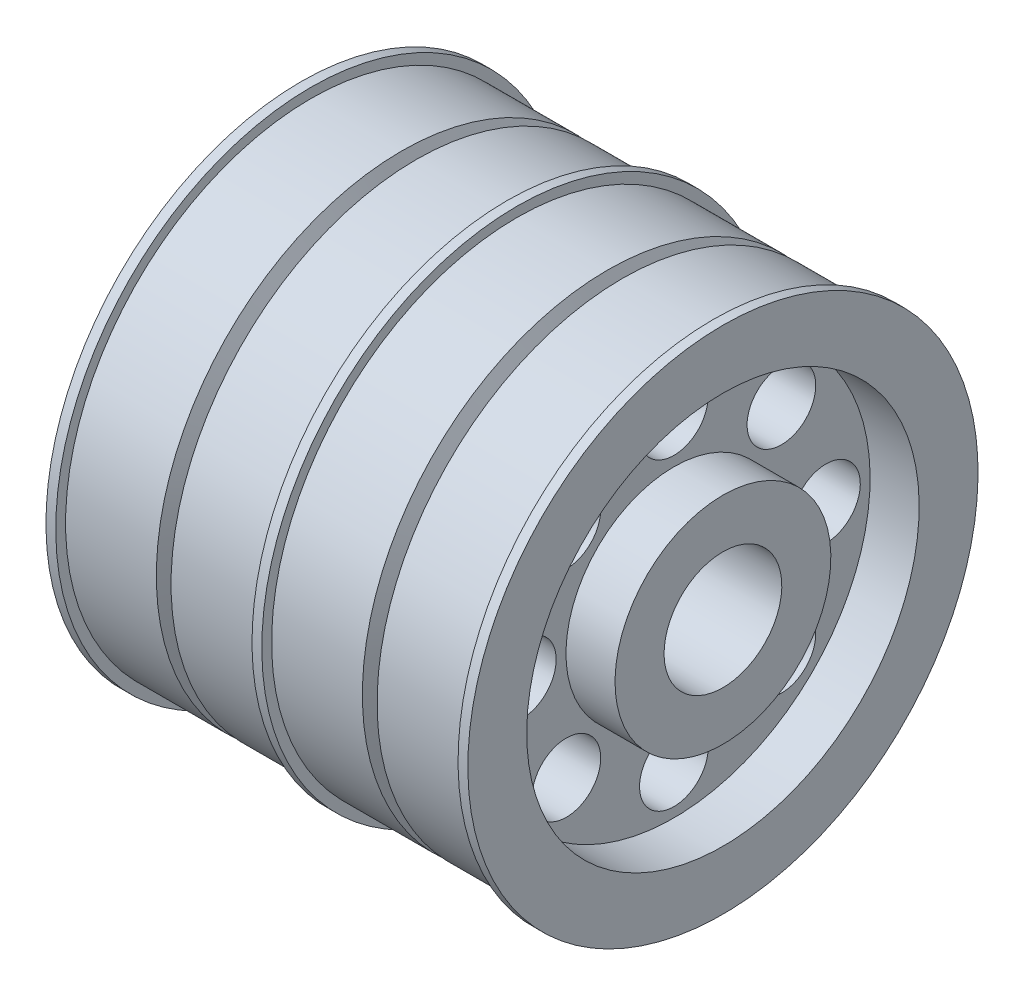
SolidWorks part; units mm, degrees
ref_plane "Front Plane" through (0, 0, 0) normal (0, 0, 1) x (1, 0, 0)
ref_plane "Top Plane" through (0, 0, 0) normal (0, 1, 0) x (1, 0, 0)
ref_plane "Right Plane" through (0, 0, 0) normal (1, 0, 0) x (0, 0, -1)
sketch "Sketch1" plane through (0, 0, 0) normal (0, 0, 1) x (1, 0, 0)
  line L0 (0, 0) -> (0, 10)
  line L1 (0, 10) -> (10, 10)
  line L2 (10, 10) -> (10, 28)
  line L3 (10, 28) -> (0, 28)
  line L4 (0, 28) -> (0, 38)
  line L6 (86, 38) -> (86, 28)
  line L7 (86, 0) -> (0, 0)
  line L8 (86, 0) -> (86, -12) construction
  line L9 (86, -12) -> (66.3916, -12) construction
  line L10 (66.3916, -12) -> (0, -12) construction
  line L16 (44, 38) -> (62.5, 38)
  line L17 (20.5, 38) -> (23.5, 38) construction
  line L20 (0, 38) -> (0, 40)
  line L21 (0, 40) -> (2, 40)
  line L22 (2, 40) -> (2, 38)
  line L23 (84, 40) -> (84, 38)
  line L24 (86, 38) -> (86, 40)
  line L25 (86, 40) -> (84, 40)
  line L27 (44, 38) -> (44, 40)
  line L28 (44, 40) -> (42, 40)
  line L29 (42, 40) -> (42, 38)
  line L32 (43, 44) -> (43, 0) construction
  line L33 (86, 10) -> (76, 10)
  line L34 (76, 10) -> (76, 28)
  line L35 (76, 28) -> (86, 28)
  line L36 (86, 10) -> (86, 0)
  line L37 (2, 38) -> (20.5, 38)
  line L38 (62.5, 38) -> (65.5, 38) construction
  line L42 (23.5, 38) -> (42, 38)
  line L43 (65.5, 38) -> (84, 38)
  line L44 (64, 38) -> (64, 35) construction
  line L46 (20.5, 38) -> (22, 35)
  line L47 (22, 35) -> (23.5, 38)
  line L48 (62.5, 38) -> (64, 35)
  line L49 (64, 35) -> (65.5, 38)
  point P16 (43, 44)
  point P18 (65.5, 38.0005)
  point P29 (43, 44)
  dimension "D1" = 12
  dimension "D3" = 50
  dimension "D4" = 2
  dimension "D5" = 3
  dimension "D6" = 2
  dimension "D7" = 2
  dimension "D8" = 2
  dimension "D9" = 10
  dimension "D10" = 10
  dimension "D11" = 10
  dimension "D12" = 3
  dimension "D13" = 3
  dimension "D14" = 2
  dimension "D15" = 2
  dimension "D16" = 86
  dimension "D17" = 2
  dimension "D18" = 18.5
  dimension "D19" = 18.5
  dimension "D20" = 18.5
  dimension "D21" = 18.5
revolve "Revolve1" add sketch "Sketch1" angle 360 about L10
ref_plane "outer " through (22, 0, 0) normal (-1, 0, 0) x (0, 0, 1)
ref_plane "inner" through (64, 0, 0) normal (1, 0, 0) x (0, 0, -1)
sketch "Sketch3" plane through (0, 0, 0) normal (-1, 0, 0) x (0, 0, 1)
  line L0 (-52, -12) -> (52, -12)
  circle A0 centre (0, -12) radius 52 construction
ref_plane "slice" through (0, -12, 0) normal (0, 1, 0) x (0, 0, 1)
sketch "Sketch4" plane through (76, 0, 0) normal (1, 0, 0) x (0, 0, -1)
  line L0 (0, 10) -> (0, 28) construction
  circle A0 centre (0, -12) radius 22 construction
  circle A1 centre (0, -12) radius 22 construction
  circle A2 centre (0, -12) radius 40 construction
  circle A3 centre (0, 19) radius 7
  circle A6 centre (0, -43) radius 7
  circle A9 centre (21.9203, 9.9203) radius 7
  circle A10 centre (31, -12) radius 7
  circle A11 centre (21.9203, -33.9203) radius 7
  circle A12 centre (0, -43) radius 7
  circle A13 centre (-21.9203, -33.9203) radius 7
  circle A14 centre (-31, -12) radius 7
  circle A15 centre (-21.9203, 9.9203) radius 7
  circle A16 centre (-26.8468, 3.5) radius 7
  circle A17 centre (-26.8468, -27.5) radius 7
  circle A18 centre (26.8468, 3.5) radius 7
  circle A19 centre (26.8468, -27.5) radius 7
  point P24 (0, -12)
  point P39 (0, -12)
  dimension "D1" = 14
  dimension "D2" = 6
  dimension "D3" = 8
extrude "Cut-Extrude1" cut sketch "Sketch4" against normal through all contours A15 | A3 L0 | A14 | A13 | A6 | A11 | A10 | A9 | L0 A3
